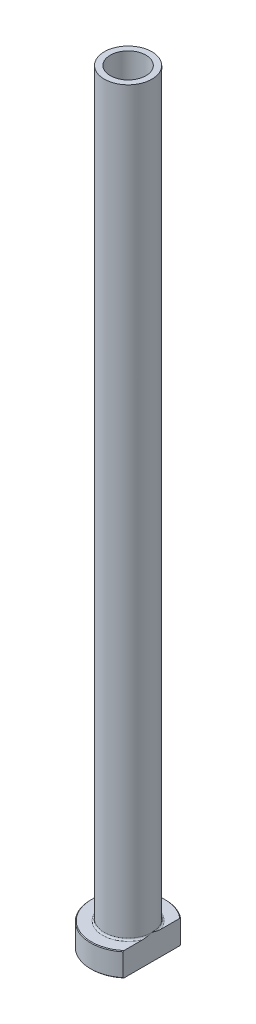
SolidWorks part; units mm, degrees
ref_plane "Front Plane" through (0, 0, 0) normal (0, 0, 1) x (1, 0, 0)
ref_plane "Top Plane" through (0, 0, 0) normal (0, 1, 0) x (1, 0, 0)
ref_plane "Right Plane" through (0, 0, 0) normal (1, 0, 0) x (0, 0, -1)
sketch "Sketch1" plane through (0, 0, 0) normal (0, 0, 1) x (1, 0, 0)
  line L0 (-5.25, 225) -> (-7, 225)
  line L1 (-7, 225) -> (-7, 7)
  line L2 (-7, 7) -> (-11, 7)
  line L3 (-11, 7) -> (-11, 0)
  line L4 (9.9, 0) -> (-9.9, 0) construction
  line L5 (-11, 0) -> (-5.5, 0)
  line L6 (-5.25, 170) -> (-5.25, 225)
  line L7 (0, 92.1877) -> (0, -15.5353) construction
  line L8 (0, -12.1) -> (0, 12.1) construction
  line L9 (-5.25, 170) -> (-5.5, 158)
  line L10 (-5.5, 158) -> (-5.5, 0)
  dimension "D1" = 0.25
  dimension "ID" = 10.5
  dimension "OD" = 14
  dimension "L" = 225
  dimension "H" = 22
  dimension "T" = 7
  dimension "N" = 55
  dimension "D2" = 12
  dimension "L-N" = 170
revolve "Revolve1" add sketch "Sketch1" angle 360 about L7
fillet "Fillet1" radius 0.5 1 edges at (0, 7, 7)
chamfer "Chamfer1" distance 0.2 angle 45 2 edges at (0, 7, 11) (0, 0, 11)
sketch "Sketch2" plane through (0, 0, 0) normal (0, -1, 0) x (1, 0, 0)
  line L0 (7, 8.4853) -> (7, -8.4853)
  circle A0 centre (0, 0) radius 11 construction
  arc A1 (7, 8.4853) -> (7, -8.4853) centre (0, 0) cw
  circle A2 centre (0, 0) radius 7 construction
extrude "Cut-Extrude1" cut sketch "Sketch2" against normal through all
chamfer "Chamfer2" distance 0.5 angle 45 1 edges at (0, 0, 5.5)
